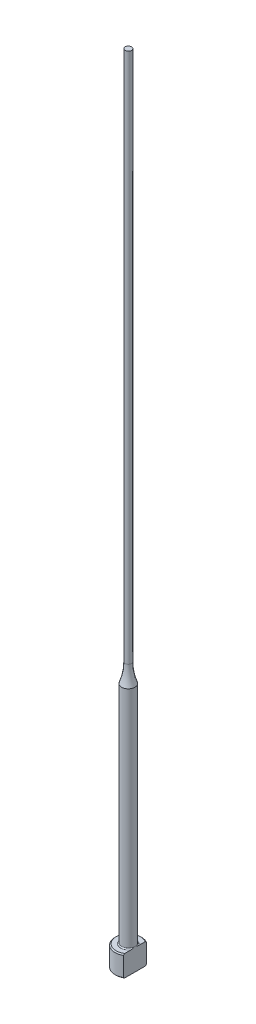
SolidWorks part; units mm, degrees
ref_plane "Front Plane" through (0, 0, 0) normal (0, 0, 1) x (1, 0, 0)
ref_plane "Top Plane" through (0, 0, 0) normal (0, 1, 0) x (1, 0, 0)
ref_plane "Right Plane" through (0, 0, 0) normal (1, 0, 0) x (0, 0, -1)
sketch "Sketch1" plane through (0, 0, 0) normal (0, 0, 1) x (1, 0, 0)
  line L0 (0, 259.9588) -> (0, -15.1925) construction
  line L1 (0, 0) -> (-2.5, 0)
  line L2 (-2.5, 0) -> (-2.5, 4)
  line L3 (-2.5, 4) -> (-1.25, 4)
  line L4 (-0.6, 50) -> (-0.6, 150)
  line L5 (-0.6, 150) -> (0, 150)
  line L6 (0, 150) -> (0, 0)
  line L7 (-1.25, 4) -> (-1.25, 46.4535)
  arc A0 (-1.25, 46.4535) -> (-0.6, 50) centre (-10.6, 50) ccw
  point P13 (-1.25, 0)
  dimension "D1" = 10
  dimension "L" = 150
  dimension "H" = 5
  dimension "T" = 4
  dimension "D" = 1.2
  dimension "B" = 2.5
  dimension "S" = 50
revolve "Revolve1" add sketch "Sketch1" angle 360 about L0
chamfer "Chamfer1" distance 0.2 angle 45 2 edges at (0, 4, 2.5) (0, 0, 2.5)
fillet "Fillet1" radius 0.2 1 edges at (0, 4, 1.25)
sketch "Sketch2" plane through (0, 0, 0) normal (0, 1, 0) x (1, 0, 0)
  line L0 (1.25, -2.1651) -> (1.25, 2.1651)
  circle A0 centre (0, 0) radius 2.5 construction
  arc A1 (1.25, -2.1651) -> (1.25, 2.1651) centre (0, 0) ccw
  circle A2 centre (0, 0) radius 1.25 construction
extrude "Keyed Head" cut sketch "Sketch2" along normal through all
